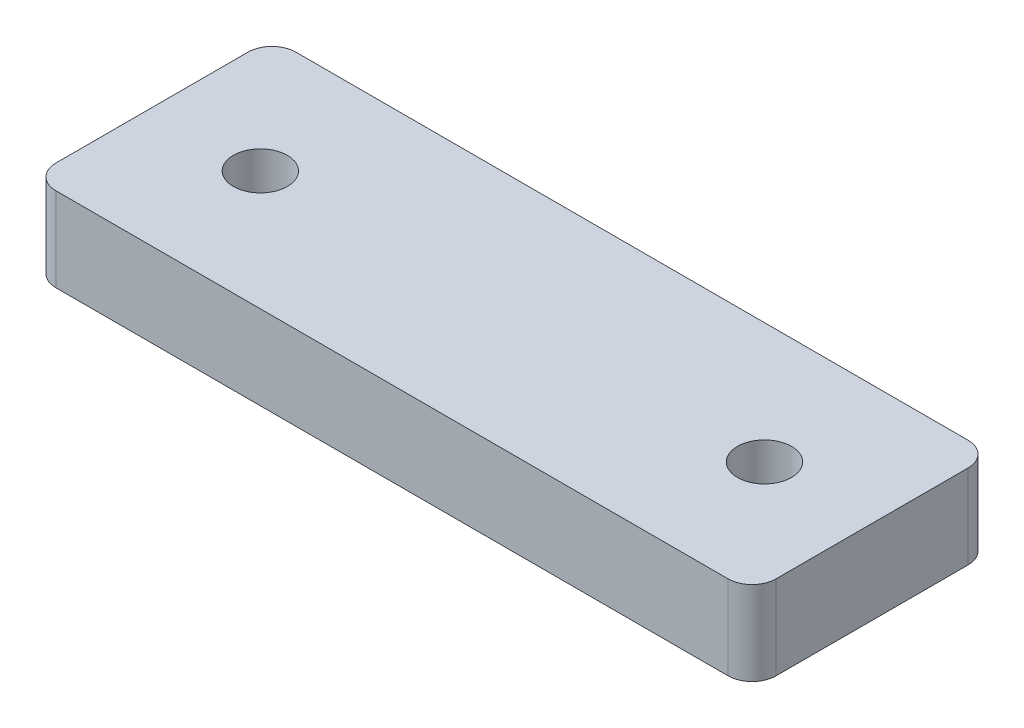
SolidWorks part; units mm, degrees
ref_plane "Alzado" through (0, 0, 0) normal (0, 0, 1) x (1, 0, 0)
ref_plane "Planta" through (0, 0, 0) normal (0, 1, 0) x (1, 0, 0)
ref_plane "Vista lateral" through (0, 0, 0) normal (1, 0, 0) x (0, 0, -1)
sketch "Croquis1" plane through (0, 0, 0) normal (0, 0, 1) x (1, 0, 0)
  line L1 (-631.6054, 53.1986) -> (-571.6054, 53.1986)
  line L2 (-631.6054, 53.1986) -> (-631.6054, 46.1986)
  line L3 (-631.6054, 46.1986) -> (-571.6054, 46.1986)
  line L4 (-571.6054, 53.1986) -> (-571.6054, 46.1986)
  dimension "D1" = 7
  dimension "D2" = 60
extrude "Saliente-Extruir1" add sketch "Croquis1" along normal blind 20
fillet "Redondeo1" radius 2 4 edges at (-571.6054, 49.6986, 0) (-571.6054, 49.6986, 20) (-631.6054, 49.6986, 20) (-631.6054, 49.6986, 0)
sketch "Croquis2" plane through (0, 53.1986, 0) normal (0, 1, 0) x (1, 0, 0)
  circle A0 centre (-580.522, -10.05) radius 2.25
  circle A1 centre (-622.522, -10.05) radius 2.25
extrude "Cortar-Extruir1" cut sketch "Croquis2" against normal blind 20
